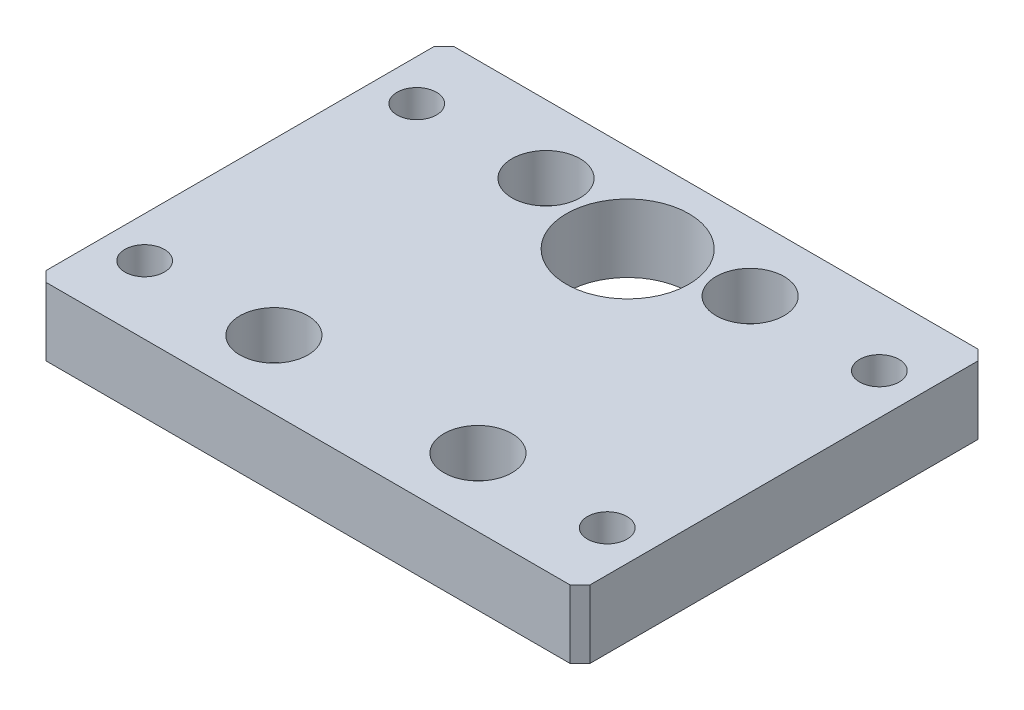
SolidWorks part; units mm, degrees
ref_plane "Спереди" through (0, 0, 0) normal (0, 0, 1) x (1, 0, 0)
ref_plane "Сверху" through (0, 0, 0) normal (0, 1, 0) x (1, 0, 0)
ref_plane "Справа" through (0, 0, 0) normal (1, 0, 0) x (0, 0, -1)
sketch "Эскиз1" plane through (0, 0, 0) normal (0, 1, 0) x (1, 0, 0)
  line L1 (40, -30) -> (-40, -30)
  line L2 (40, -30) -> (40, 30)
  line L3 (40, 30) -> (-40, 30)
  line L4 (-40, -30) -> (-40, 30)
  line L5 (0, 30) -> (0, -30) construction
  line L6 (40, 0) -> (-40, 0) construction
  circle A0 centre (-34, 20) radius 2.9
  circle A1 centre (-15, 20) radius 2.9
  circle A2 centre (15, 20) radius 2.9
  circle A3 centre (34, 20) radius 2.9
  circle A4 centre (34, -20) radius 2.9
  circle A5 centre (15, -20) radius 2.9
  circle A6 centre (-15, -20) radius 2.9
  circle A7 centre (-34, -20) radius 2.9
  circle A8 centre (0, 17) radius 9
  point P0 (0, 0)
  dimension "D3" = 5.8
  dimension "D4" = 68
  dimension "D5" = 30
  dimension "D6" = 40
  dimension "D7" = 18
  dimension "D1" = 80
  dimension "D2" = 60
  dimension "D8" = 13
extrude "Бобышка-Вытянуть1" add sketch "Эскиз1" along normal blind 10
sketch "Эскиз2" plane through (0, 10, 0) normal (0, 1, 0) x (1, 0, 0)
  circle A0 centre (-15, 20) radius 5
  circle A1 centre (15, 20) radius 5
  circle A2 centre (15, -20) radius 5
  circle A3 centre (-15, -20) radius 5
  dimension "D1" = 10
extrude "Вырез-Вытянуть1" cut sketch "Эскиз2" against normal blind 7
chamfer "Фаска1" distance 1.5 angle 45 4 edges at (-40, 5, -30) (-40, 5, 30) (40, 5, 30) (40, 5, -30)
